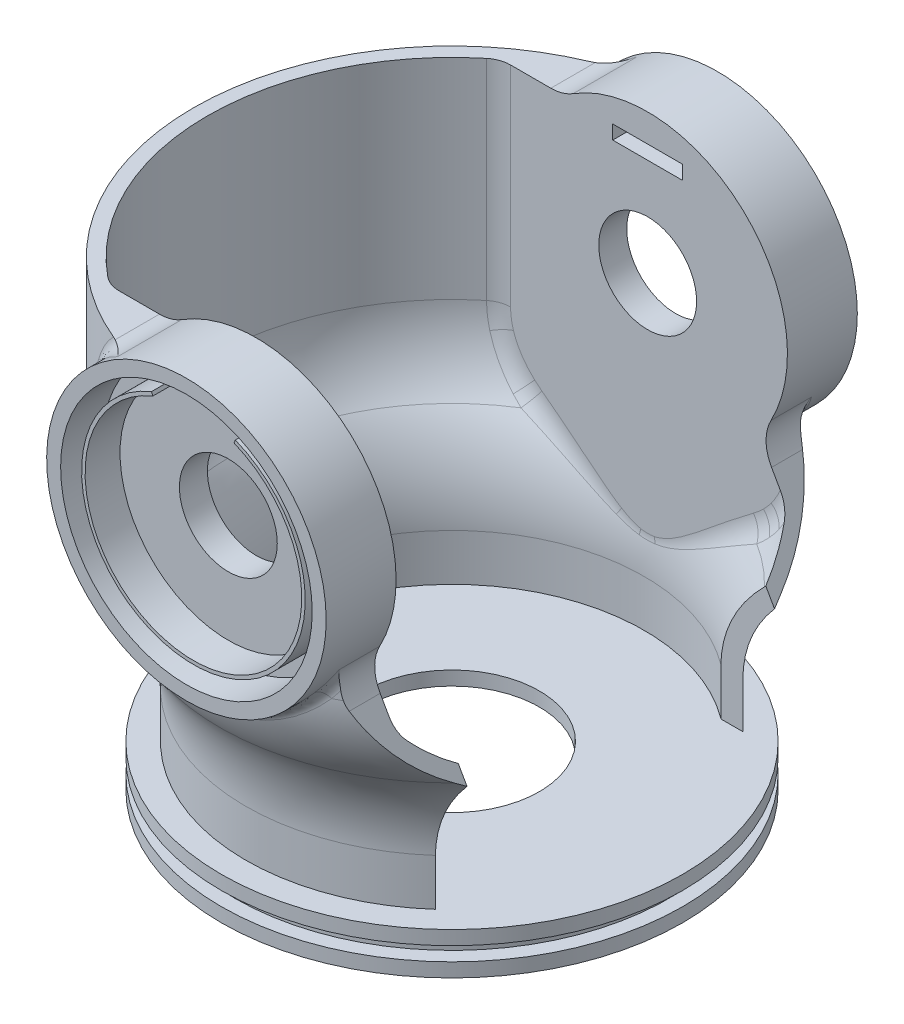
SolidWorks part; units mm, degrees
ref_plane "Front Plane" through (0, 0, 0) normal (0, 0, 1) x (1, 0, 0)
ref_plane "Top Plane" through (0, 0, 0) normal (0, 1, 0) x (1, 0, 0)
ref_plane "Right Plane" through (0, 0, 0) normal (1, 0, 0) x (0, 0, -1)
sketch "Sketch1" plane through (0, 0, 0) normal (0, 0, 1) x (1, 0, 0)
  line L0 (0, 0) -> (14.75, 0)
  line L1 (14.75, 0) -> (14.75, 4.3408)
  line L2 (18.5, 16) -> (18.5, 31)
  line L3 (0, 0) -> (0, 31) construction
  line L4 (0, 31) -> (18.5, 31)
  line L5 (0, 0) -> (0, 31)
  arc A0 (14.75, 4.3408) -> (16.625, 10.1704) centre (24.75, 4.3408) cw
  arc A1 (16.625, 10.1704) -> (18.5, 16) centre (8.5, 16) ccw
  dimension "D4" = 10
  dimension "D1" = 29.5
  dimension "D2" = 37
  dimension "D3" = 31
  dimension "D5" = 15
revolve "Revolve1" add sketch "Sketch1" angle 180 about L3
sketch "Sketch5" plane through (0, 0, 0) normal (0, 0, 1) x (1, 0, 0)
  line L0 (14.7718, 5) -> (0, 31)
  line L2 (18.5, 31) -> (-18.5, 31) construction
  line L4 (-14.75, 0) -> (14.75, 0) construction
  arc A1 (16.625, 10.1704) -> (14.75, 4.3408) centre (24.75, 4.3408) ccw construction
  dimension "D1" = 5
extrude "Cut-Extrude1" cut sketch "Sketch5" against normal through all and the other way through all flip side to cut
shell "Shell3" thickness 1
ref_plane "Plane3" through (0, 0, 14) normal (0, 0, 1) x (1, 0, 0)
sketch "Sketch12" plane through (0, 0, 14) normal (0, 0, 1) x (1, 0, 0)
  line L0 (50, 0) -> (-50, 0) construction
  line L1 (0, -19.25) -> (0, 19.25) construction
  circle A0 centre (0, 23) radius 10
  dimension "D1" = 20
  dimension "D2" = 33
extrude "Extrude3" add sketch "Sketch12" along normal blind 5
sketch "Sketch13" plane through (0, 0, 14) normal (0, 0, 1) x (1, 0, 0)
  line L0 (-10.5, 16) -> (-10.5, 31)
  line L1 (-10.5, 16) -> (-10.5, 31)
  line L2 (11.503, 10.7533) -> (8.5222, 16) construction
  line L3 (8.5222, 16) -> (7.9738, 16.9652) construction
  line L4 (9.919, 13.5414) -> (8.5222, 16)
  line L5 (8.5222, 16) -> (0, 31)
  line L6 (-6, 31) -> (-17.5, 31) construction
  line L7 (0, 31) -> (-10.5, 31)
  spline S0 degree 3 poles (-1610.744, 1184.5582) (-96.715, 147.1663) (24.7357, 34.5336) (9.246, 12.4544) (9.0415, 12.2045) (-14.2558, -12.5969) (-184.9404, 149.683) (1168.0357, -1616.7433) knots -20.598719 -20.598719 -20.598719 -20.598719 0.25 0.25 0.5 0.5 26.706636 26.706636 26.706636 26.706636 only from (9.919, 13.5414) to (7.3509, 10.7533)
  spline S1 degree 3 poles (9.919, 13.5414) (9.7769, 13.2523) (9.6131, 12.9776) (9.246, 12.4544) (9.0415, 12.2045) (8.381, 11.5014) (7.887, 11.1007) (7.3509, 10.7533) knots 0 0 0 0 0.25 0.25 0.5 0.5 1 1 1 1
  spline S2 degree 3 poles (-1247.715, -1556.5616) (227.3789, 167.0399) (17.8849, -14.0712) (-8.9779, 12.113) (-9.3228, 12.5315) (-9.7469, 13.2052) (-9.8737, 13.4381) (-10.096, 13.9219) (-10.1919, 14.1748) (-19.9885, 46.8844) (270.5798, 128.8134) (1943.6429, 438.5192) knots -17.177617 -17.177617 -17.177617 -17.177617 0.25 0.25 0.5 0.5 0.625 0.625 0.75 0.75 16.634825 16.634825 16.634825 16.634825 only from (-7.3509, 10.7533) to (-10.5, 16)
  spline S3 degree 3 poles (-7.3509, 10.7533) (-7.8006, 11.0447) (-8.2181, 11.3724) (-8.9779, 12.113) (-9.3228, 12.5315) (-9.7469, 13.2052) (-9.8737, 13.4381) (-10.096, 13.9219) (-10.1919, 14.1748) (-10.4214, 14.941) (-10.5, 15.464) (-10.5, 16) knots 0 0 0 0 0.25 0.25 0.5 0.5 0.625 0.625 0.75 0.75 1 1 1 1
  spline S4 degree 3 poles (982.7721, -1733.5918) (86.542, 44.2576) (40.6956, 33.6427) (4.9991, 9.1692) (4.4176, 8.7637) (3.5342, 8.1715) (3.2379, 7.9771) (2.6368, 7.6033) (2.3322, 7.4237) (1.7037, 7.0981) (1.3767, 6.9505) (0.8704, 6.7901) (0.699, 6.747) (0.3494, 6.6878) (0.1696, 6.6722) (-0.1851, 6.6731) (-0.361, 6.6892) (-0.6229, 6.7344) (-0.7099, 6.753) (-0.8833, 6.7964) (-0.9727, 6.8221) (-1.4026, 6.9605) (-1.7248, 7.1081) (-2.351, 7.4345) (-2.6545, 7.6139) (-3.2531, 7.9869) (-3.5481, 8.1808) (-4.428, 8.771) (-5.0082, 9.1754) (-40.8425, 33.7408) (-84.4372, 42.4109) (-1003.9598, -1721.6203) knots -7.380993 -7.380993 -7.380993 -7.380993 0.125 0.125 0.25 0.25 0.3125 0.3125 0.375 0.375 0.4375 0.4375 0.46875 0.46875 0.5 0.5 0.53125 0.53125 0.546875 0.546875 0.5625 0.5625 0.625 0.625 0.6875 0.6875 0.75 0.75 0.875 0.875 8.433454 8.433454 8.433454 8.433454 only from (7.3509, 10.7533) to (-7.3509, 10.7533)
  spline S5 degree 3 poles (7.3509, 10.7533) (6.7563, 10.3681) (6.1686, 9.971) (4.9991, 9.1692) (4.4176, 8.7637) (3.5342, 8.1715) (3.2379, 7.9771) (2.6368, 7.6033) (2.3322, 7.4237) (1.7037, 7.0981) (1.3767, 6.9505) (0.8704, 6.7901) (0.699, 6.747) (0.3494, 6.6878) (0.1696, 6.6722) (-0.1851, 6.6731) (-0.361, 6.6892) (-0.6229, 6.7344) (-0.7099, 6.753) (-0.8833, 6.7964) (-0.9727, 6.8221) (-1.4026, 6.9605) (-1.7248, 7.1081) (-2.351, 7.4345) (-2.6545, 7.6139) (-3.2531, 7.9869) (-3.5481, 8.1808) (-4.428, 8.771) (-5.0082, 9.1754) (-6.1741, 9.9747) (-6.7594, 10.3701) (-7.3509, 10.7533) knots 0 0 0 0 0.125 0.125 0.25 0.25 0.3125 0.3125 0.375 0.375 0.4375 0.4375 0.46875 0.46875 0.5 0.5 0.53125 0.53125 0.546875 0.546875 0.5625 0.5625 0.625 0.625 0.6875 0.6875 0.75 0.75 0.875 0.875 1 1 1 1
extrude "Extrude5" add sketch "Sketch13" along normal up to body separate body
sketch "Sketch11" plane through (0, 1, 0) normal (0, 1, 0) x (-1, 0, 0)
  circle A0 centre (0, 0) radius 6.25
  dimension "D1" = 12.5
extrude "Cut-Extrude3" cut sketch "Sketch11" against normal through all
fillet "Fillet4" radius 2 13 edges
fillet "Fillet9" radius 3 1 edges at (-6, 31, 15.75)
fillet "Fillet11" radius 3 4 edges at (8.2491, 16.4806, 16.5591) (7.9738, 16.9652, 15.3467) (8.5222, 16, 14.6424) (8.248, 16.4826, 14)
fillet "Fillet12" radius 1 3 edges at (-9.7817, 25.078, 15.7025) (-1.6049, 13.1296, 18.0078)
sketch "Sketch16" plane through (0, 0, 0) normal (0, 0, -1) x (-1, 0, 0)
  line L0 (-16.5, -1) -> (-16.5, -2)
  line L1 (-14.75, 1) -> (-16.5, 1)
  line L2 (-14.75, 1) -> (-14.75, -2)
  line L3 (-14.75, -2) -> (-16.5, -2)
  line L4 (-16.5, 1) -> (-16.5, 0)
  line L5 (-16.5, 0) -> (-15.5, 0)
  line L6 (0, 0) -> (0, 6.5274) construction
  line L7 (-16.5, -1) -> (-15.5, -1)
  line L8 (-15.5, 0) -> (-15.5, -1)
  line L10 (-14.75, 0) -> (-14.75, 4.3408) construction
  line L11 (-14.75, 0) -> (-6.25, 0) construction
  dimension "D1" = 33
  dimension "D2" = 3
  dimension "D3" = 1
revolve "Revolve2" add sketch "Sketch16" angle 180 about L6
sketch "Sketch18" plane through (0, 0, 19) normal (0, 0, 1) x (1, 0, 0)
  circle A2 centre (0, 23) radius 9
  circle A3 centre (0, 23) radius 9
  dimension "D1" = 1
extrude "Cut-Extrude5" cut sketch "Sketch18" against normal blind 3
sketch "Sketch19" plane through (0, 0, 16) normal (0, 0, 1) x (1, 0, 0)
  line L0 (0, 23) -> (0, 30) construction
  line L1 (-2.5, 31) -> (2.5, 31)
  line L2 (-2.5, 31) -> (-2.5, 30)
  line L3 (-2.5, 30) -> (2.5, 30)
  line L4 (2.5, 31) -> (2.5, 30)
  circle A2 centre (0, 23) radius 10 construction
  dimension "D1" = 1
  dimension "D2" = 5
  dimension "D3" = 2
extrude "Cut-Extrude6" cut sketch "Sketch19" against normal through all
sketch "Sketch20" plane through (0, 0, 16) normal (0, 0, 1) x (1, 0, 0)
  line L0 (2.5, 30) -> (2.5, 31) construction
  line L1 (-2.5, 31) -> (-2.5, 30) construction
  arc A0 (3, 30.4162) -> (-3, 30.4162) centre (0, 23) cw
  dimension "D3" = 8
  dimension "D1" = 0.5
  dimension "D2" = 0.5
extrude "Extrude-Thin1" add sketch "Sketch20" along normal offset from surface (2.5 mm away) 0.5 thin
hole_wizard "M7.0 (7) Diameter Hole1" positions "Sketch22" profile "Sketch21" hole size "M7.0" standard "Ansi Metric"
sketch "Sketch22" plane through (0, 0, 16) normal (0, 0, 1) x (1, 0, 0)
  point P0 (0, 23)
sketch "Sketch21" plane through (0, 23, 16) normal (1, 0, 0) x (0, -1, 0)
  line L0 (0, 0) -> (0, 16)
  line L1 (0, 16) -> (3.5, 16)
  line L2 (3.5, 16) -> (3.5, 0)
  line L5 (3.5, 0) -> (0, 0)
  line L11 (0, -6.35) -> (0, 107.95) construction
  dimension "Thru Hole Dia." = 7
  dimension "Thru Hole Depth" = 16
sketch "Sketch6" plane through (0, 1, 0) normal (0, 1, 0) x (-1, 0, 0)
  line L0 (0, 0) -> (-14.7718, 0) construction
  line L1 (-14.7718, 11) -> (-14.7718, -11)
  line L2 (-14.7718, -11) -> (0, -11)
  line L3 (-14.7718, 11) -> (0, 11)
  line L4 (0, -11) -> (0, 11)
  spline S0 degree 3 poles (-11.8342, 11.6765) (-12.1539, 10.7778) (-12.481, 9.8888) (-13.1202, 8.0912) (-13.4328, 7.1834) (-13.8611, 5.769) (-13.997, 5.2887) (-14.1847, 4.5473) (-14.2446, 4.2966) (-14.3576, 3.7867) (-14.411, 3.5262) (-14.6538, 2.214) (-14.7718, 1.1319) (-14.7718, 0) knots 0 0 0 0 0.25 0.25 0.5 0.5 0.625 0.625 0.6875 0.6875 0.75 0.75 1 1 1 1 construction
  dimension "D1" = 22
extrude "Cut-Extrude2" cut sketch "Sketch6" along normal through all
mirror "Mirror2"
sketch "Sketch17" plane through (0, 1, 0) normal (0, 1, 0) x (-1, 0, 0)
  line L0 (0, 0) -> (0, 6.75) construction
  line L1 (-3, 6.75) -> (-3, 5.4829)
  line L2 (-3, 6.75) -> (3, 6.75)
  line L3 (3, 6.75) -> (3, 5.4829)
  circle A0 centre (0, 0) radius 6.25 construction
  dimension "D1" = 6
  dimension "D2" = 13
extrude "Cut-Extrude4" cut sketch "Sketch17" against normal through all and the other way through all flip side to cut
